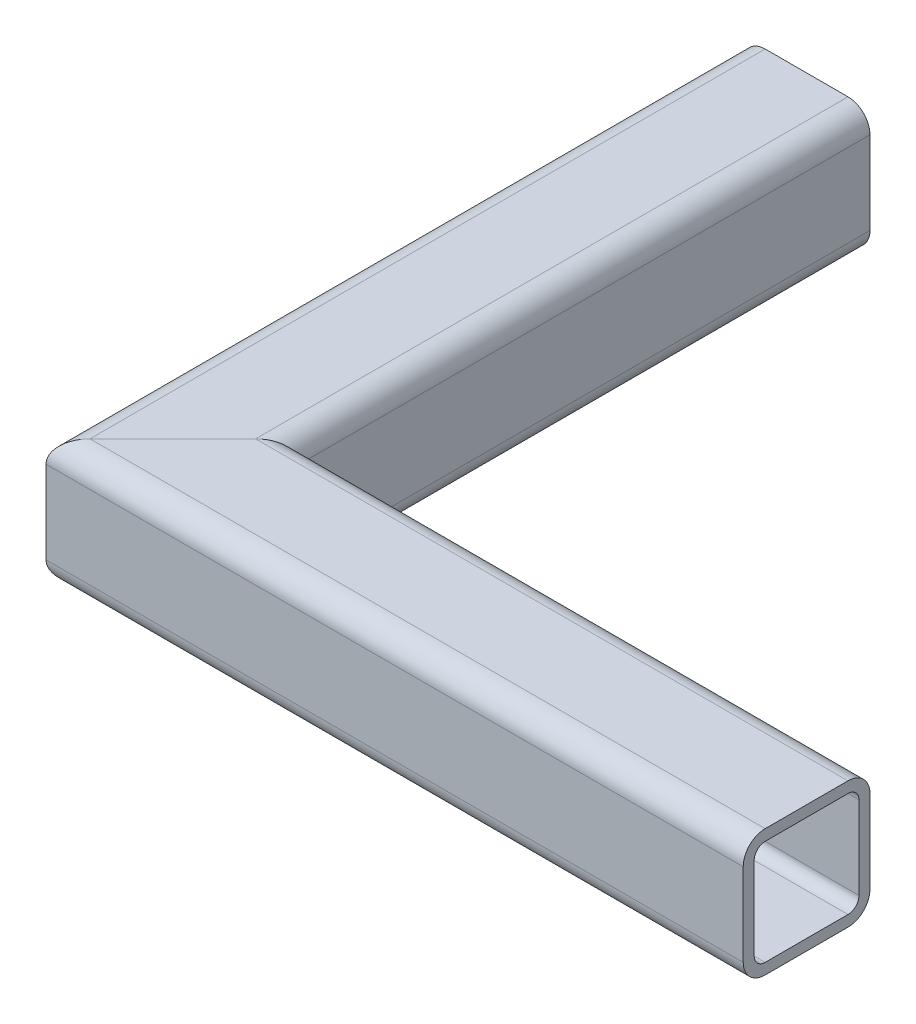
SolidWorks part; units mm, degrees
ref_plane "Front Plane" through (0, 0, 0) normal (0, 0, 1) x (1, 0, 0)
ref_plane "Top Plane" through (0, 0, 0) normal (0, 1, 0) x (1, 0, 0)
ref_plane "Right Plane" through (0, 0, 0) normal (1, 0, 0) x (0, 0, -1)
sketch "Sketch1" plane through (0, 0, 0) normal (0, 1, 0) x (1, 0, 0)
  line L0 (0, 150) -> (0, 0)
  line L1 (0, 0) -> (150, 0)
  dimension "D1" = 150
other "Square tube 30 X 30 X 2.6(1)"
ref_plane "Plane1" through (0, 0, 0) normal (1, 0, 0) x (0, 0, -1)
sketch "Sketch115" plane through (0, 0, 0) normal (1, 0, 0) x (0, 0, -1)
  line L0 (-9.8, -12.4) -> (9.8, -12.4)
  line L1 (-12.4, -9.8) -> (-12.4, 9.8)
  line L2 (9.8, 12.4) -> (-9.8, 12.4)
  line L3 (12.4, 9.8) -> (12.4, -9.8)
  line L4 (-9.8, -15) -> (9.8, -15)
  line L5 (-15, -9.8) -> (-15, 9.8)
  line L6 (9.8, 15) -> (-9.8, 15)
  line L7 (15, 9.8) -> (15, -9.8)
  arc A0 (15, 9.8) -> (9.8, 15) centre (9.8, 9.8) ccw
  arc A1 (9.8, -15) -> (15, -9.8) centre (9.8, -9.8) ccw
  arc A2 (-15, -9.8) -> (-9.8, -15) centre (-9.8, -9.8) ccw
  arc A3 (-9.8, 15) -> (-15, 9.8) centre (-9.8, 9.8) ccw
  arc A4 (-9.8, 12.4) -> (-12.4, 9.8) centre (-9.8, 9.8) ccw
  arc A5 (12.4, 9.8) -> (9.8, 12.4) centre (9.8, 9.8) ccw
  arc A6 (9.8, -12.4) -> (12.4, -9.8) centre (9.8, -9.8) ccw
  arc A7 (-12.4, -9.8) -> (-9.8, -12.4) centre (-9.8, -9.8) ccw
  point P0 (-15, 0)
  point P1 (15, 0)
  point P2 (0, 15)
  point P3 (0, -15)
  point P4 (0, 0)
  point P5 (-15, -15)
  point P6 (15, -15)
  point P7 (15, 15)
  point P8 (-15, 15)
  point P33 (0, 0)
  dimension "D1" = 5.2
  dimension "Thickness" = 2.6
  dimension "V_leg" = 30
other "Square tube 30 X 30 X 2.6(2)"
ref_plane "Plane2" through (0, 0, -150) normal (0, 0, 1) x (1, 0, 0)
sketch "Sketch117" plane through (0, 0, -150) normal (0, 0, 1) x (1, 0, 0)
  line L0 (-9.8, -12.4) -> (9.8, -12.4)
  line L1 (-12.4, -9.8) -> (-12.4, 9.8)
  line L2 (9.8, 12.4) -> (-9.8, 12.4)
  line L3 (12.4, 9.8) -> (12.4, -9.8)
  line L4 (-9.8, -15) -> (9.8, -15)
  line L5 (-15, -9.8) -> (-15, 9.8)
  line L6 (9.8, 15) -> (-9.8, 15)
  line L7 (15, 9.8) -> (15, -9.8)
  arc A0 (15, 9.8) -> (9.8, 15) centre (9.8, 9.8) ccw
  arc A1 (9.8, -15) -> (15, -9.8) centre (9.8, -9.8) ccw
  arc A2 (-15, -9.8) -> (-9.8, -15) centre (-9.8, -9.8) ccw
  arc A3 (-9.8, 15) -> (-15, 9.8) centre (-9.8, 9.8) ccw
  arc A4 (-9.8, 12.4) -> (-12.4, 9.8) centre (-9.8, 9.8) ccw
  arc A5 (12.4, 9.8) -> (9.8, 12.4) centre (9.8, 9.8) ccw
  arc A6 (9.8, -12.4) -> (12.4, -9.8) centre (9.8, -9.8) ccw
  arc A7 (-12.4, -9.8) -> (-9.8, -12.4) centre (-9.8, -9.8) ccw
  point P0 (-15, 0)
  point P1 (15, 0)
  point P2 (0, 15)
  point P3 (0, -15)
  point P4 (0, 0)
  point P5 (-15, -15)
  point P6 (15, -15)
  point P7 (15, 15)
  point P8 (-15, 15)
  point P33 (0, 0)
  dimension "D1" = 5.2
  dimension "Thickness" = 2.6
  dimension "V_leg" = 30
other "Trim/Extend1"
